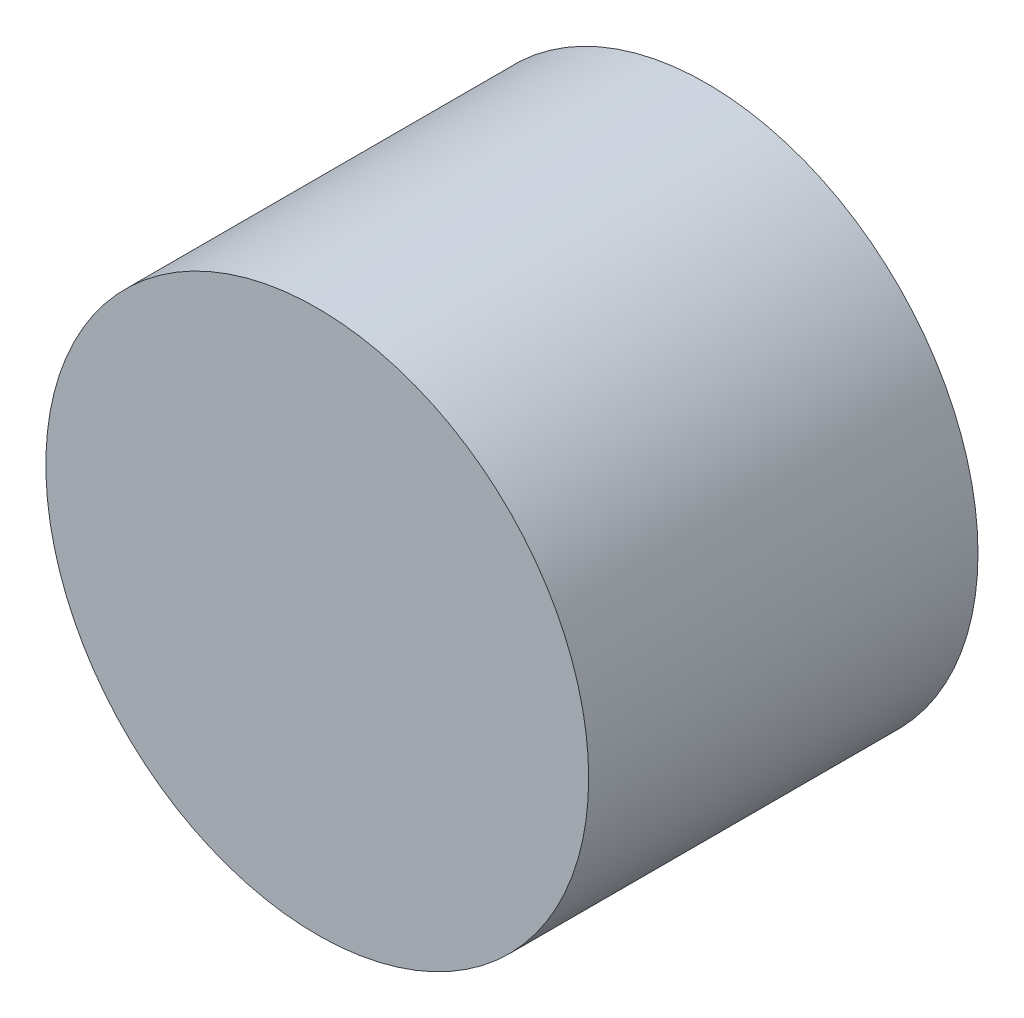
SolidWorks part; units mm, degrees
ref_plane "前视基准面" through (0, 0, 0) normal (0, 0, 1) x (1, 0, 0)
ref_plane "上视基准面" through (0, 0, 0) normal (0, 1, 0) x (1, 0, 0)
ref_plane "右视基准面" through (0, 0, 0) normal (1, 0, 0) x (0, 0, -1)
other "Configuration Table"
sketch "草图1" plane through (0, 0, 0) normal (0, 0, 1) x (1, 0, 0)
  circle A0 centre (0, 0) radius 4.95
  dimension "D1" = 9.9
extrude "Nominal_U1_body" add sketch "草图1" along normal blind 7.1
